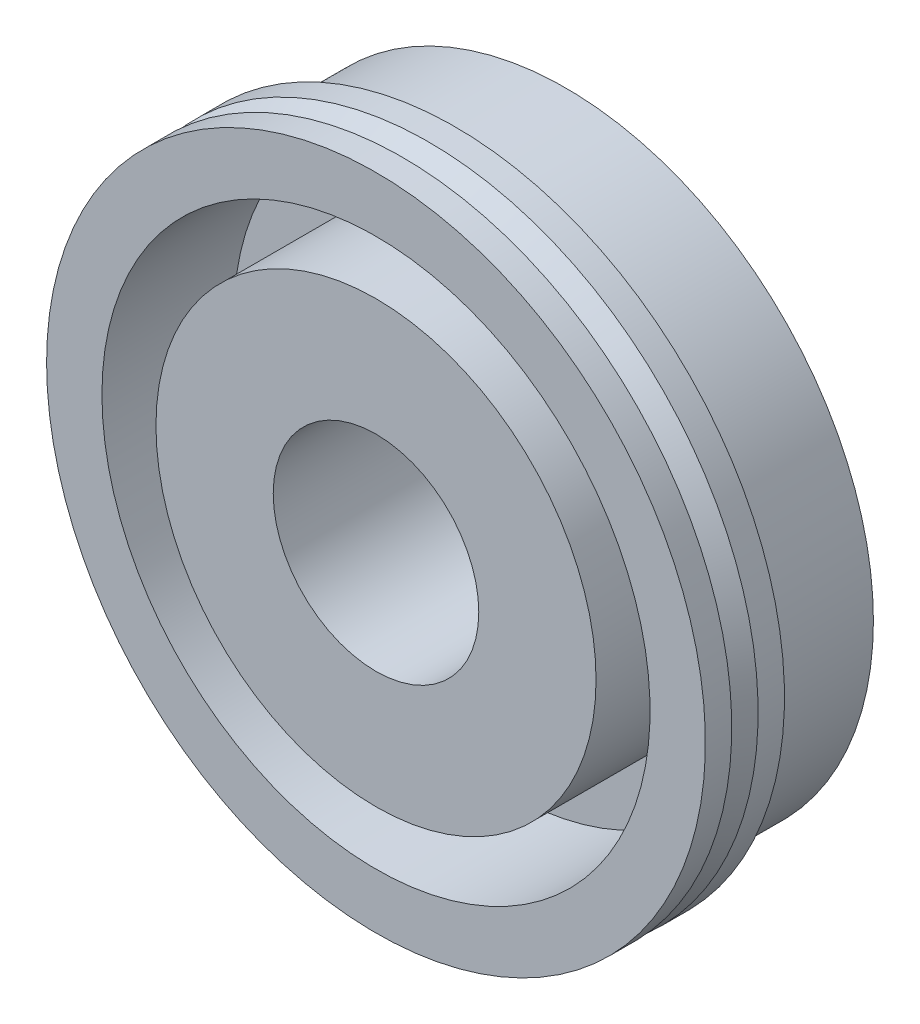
SolidWorks part; units mm, degrees
ref_plane "Plan de face" through (0, 0, 0) normal (0, 0, 1) x (1, 0, 0)
ref_plane "Plan de dessus" through (0, 0, 0) normal (0, 1, 0) x (1, 0, 0)
ref_plane "Plan de droite" through (0, 0, 0) normal (1, 0, 0) x (0, 0, -1)
sketch "Esquisse1" plane through (0, 0, 0) normal (1, 0, 0) x (0, 0, -1)
  line L0 (0, 0) -> (-7.9609, 0) construction
  line L1 (0, 3.9) -> (0, 8.35)
  line L2 (0, 8.35) -> (5, 8.35)
  line L3 (5, 8.35) -> (5, 10.4)
  line L4 (5, 10.4) -> (0, 10.4)
  line L5 (0, 10.4) -> (0, 12.5)
  line L6 (0, 12.5) -> (1, 12.5)
  line L7 (1, 12.5) -> (1, 12)
  line L8 (1, 12) -> (2, 12.5)
  line L9 (3, 12.5) -> (3, 11.675)
  line L10 (3, 11.675) -> (7.2, 11.675)
  line L11 (7.2, 11.675) -> (7.2, 3.9)
  line L12 (7.2, 3.9) -> (0, 3.9)
  line L13 (3, 12.5) -> (2, 12.5)
  dimension "D1" = 7.8
  dimension "D2" = 16.7
  dimension "D3" = 20.8
  dimension "D4" = 5
  dimension "D5" = 25
  dimension "D6" = 1
  dimension "D7" = 3
  dimension "D8" = 24
  dimension "D9" = 23.35
  dimension "D10" = 7.2
  dimension "D11" = 1
revolve "Révolution1" add sketch "Esquisse1" angle 360 about L0
